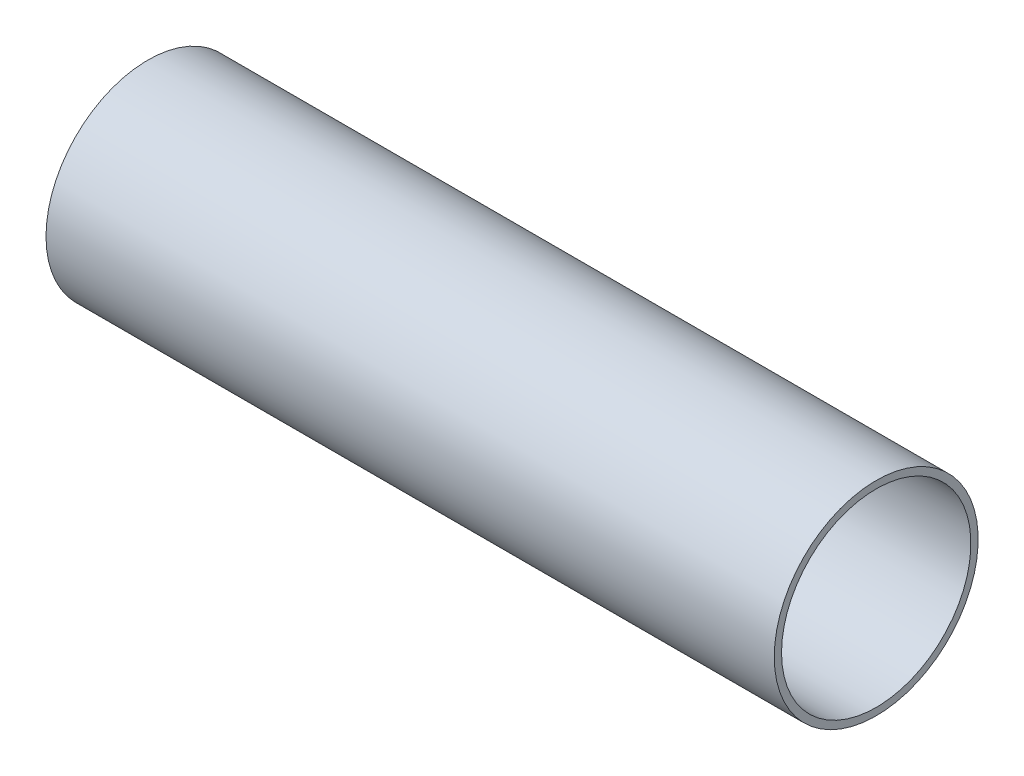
SolidWorks part; units mm, degrees
ref_plane "Plane1" through (0, 0, 0) normal (0, 0, 1) x (1, 0, 0)
ref_plane "Plane2" through (0, 0, 0) normal (0, 1, 0) x (1, 0, 0)
ref_plane "Plane3" through (0, 0, 0) normal (1, 0, 0) x (0, 0, -1)
sketch "Esquisse1" plane through (0, 0, 0) normal (0, 0, 1) x (1, 0, 0)
  line L0 (0, 0) -> (123.2563, 0) construction
  line L1 (0, 14) -> (100, 14)
  line L2 (0, 14) -> (0, 13)
  line L3 (100, 13) -> (0, 13)
  line L4 (100, 13) -> (100, 14)
  dimension "D1" = 1
  dimension "D2" = 100
  dimension "D3" = 13
revolve "Base-Révolution" add sketch "Esquisse1" angle 360 about L0
